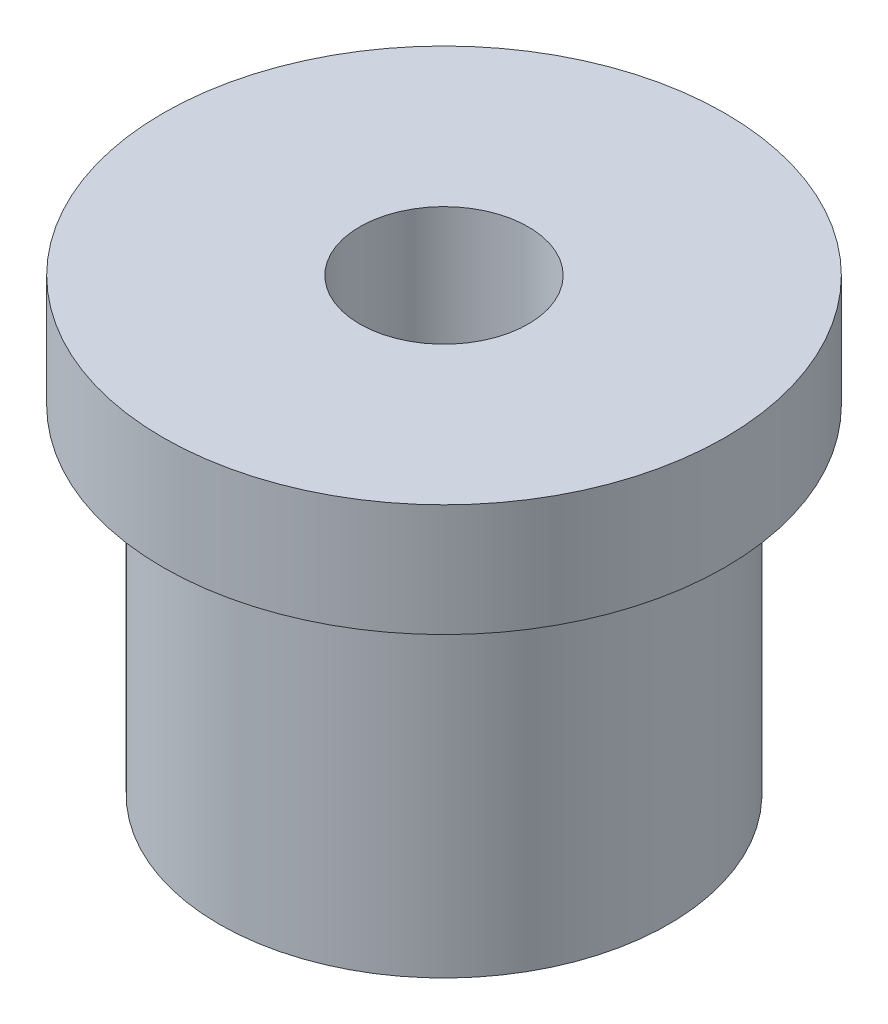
SolidWorks part; units mm, degrees
ref_plane "Face" through (0, 0, 0) normal (0, 0, 1) x (1, 0, 0)
ref_plane "Dessus" through (0, 0, 0) normal (0, 1, 0) x (1, 0, 0)
ref_plane "Droite" through (0, 0, 0) normal (1, 0, 0) x (0, 0, -1)
sketch "Esquisse1" plane through (0, 0, 0) normal (0, 0, 1) x (1, 0, 0)
  line L0 (-5, 8) -> (0, 8)
  line L1 (0, 8) -> (0, 0)
  line L2 (0, 0) -> (-4, 0)
  line L3 (-4, 0) -> (-4, 6)
  line L4 (-4, 6) -> (-5, 6)
  line L5 (-5, 6) -> (-5, 8)
  line L6 (0, 8) -> (0, 21.9978) construction
  dimension "D1" = 4
  dimension "D2" = 5
  dimension "D3" = 6
  dimension "D4" = 8
revolve "Révolution1" add sketch "Esquisse1" angle 360 about L6
sketch "Esquisse2" plane through (0, 8, 0) normal (0, 1, 0) x (-1, 0, 0)
  circle A0 centre (0, 0) radius 1.5
  circle A1 centre (0, 0) radius 5 construction
  dimension "D1" = 3
extrude "Enlèv. mat.-Extru.1" cut sketch "Esquisse2" against normal up to next
sketch "Esquisse3" plane through (0, 0, 0) normal (0, 0, 1) x (1, 0, 0)
  line L0 (0, 8) -> (0, 13.8516) construction
  line L1 (0, 8) -> (5, 8)
  line L2 (0, 8) -> (0, 0)
  line L3 (0, 0) -> (5, 0)
  line L4 (5, 8) -> (5, 0)
  line L5 (5, 6) -> (5, 8) construction
  line L6 (5, 8) -> (-5, 8) construction
  line L7 (-4, 0) -> (4, 0) construction
revolve "Coupe" [suppressed] cut sketch "Esquisse3" angle 180 about L0
